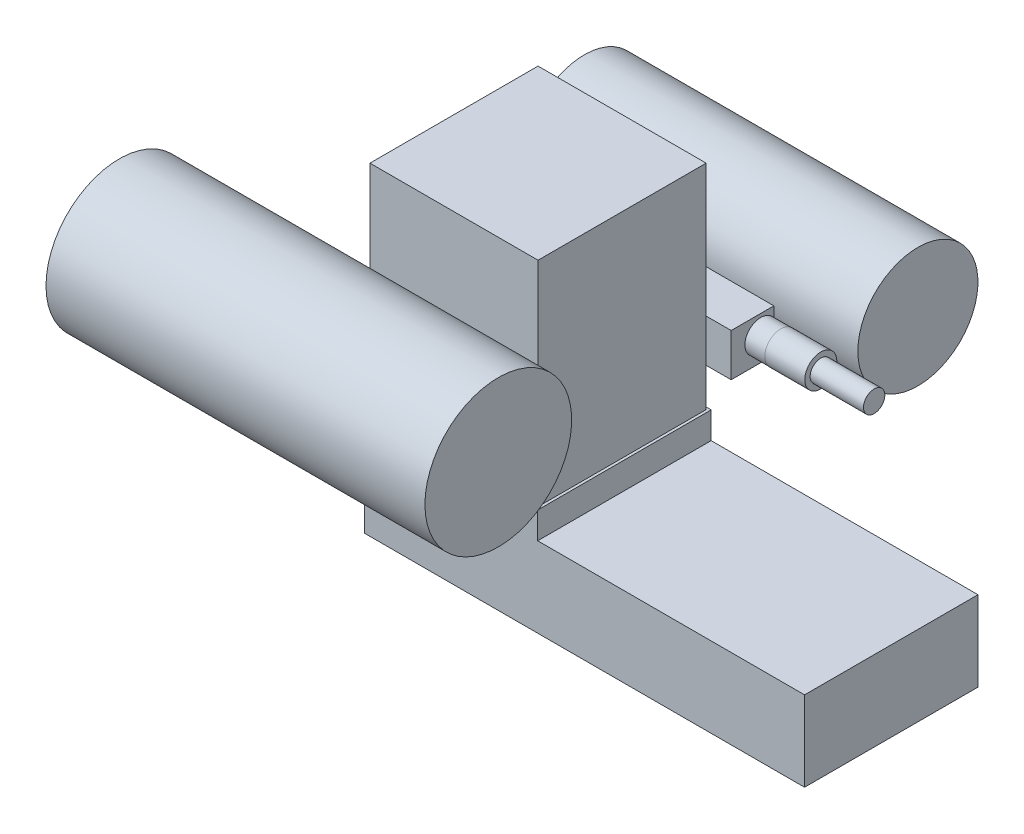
SolidWorks part; units mm, degrees
other "Spindle"
other "Compound"
other "Toolpost Holder"
other "Spindle Barrel"
other "Motor"
other "Toolpost"
ref_plane "Front Plane" through (0, 0, 0) normal (0, 0, 1) x (1, 0, 0)
ref_plane "Top Plane" through (0, 0, 0) normal (0, 1, 0) x (1, 0, 0)
ref_plane "Right Plane" through (0, 0, 0) normal (1, 0, 0) x (0, 0, -1)
sketch "Sketch1" plane through (0, 0, 0) normal (0, 1, 0) x (1, 0, 0)
  line L1 (-32.5, 32.5) -> (32.5, 32.5)
  line L2 (-32.5, 32.5) -> (-32.5, -32.5)
  line L3 (-32.5, -32.5) -> (32.5, -32.5)
  line L4 (32.5, 32.5) -> (32.5, -32.5)
  line L5 (-32.5, 32.5) -> (32.5, -32.5) construction
  line L6 (-32.5, -32.5) -> (32.5, 32.5) construction
  point P0 (0, 0)
  dimension "D1" = 65
  dimension "D2" = 65
extrude "Boss-Extrude1" add sketch "Sketch1" against normal blind 40
sketch "Sketch2" plane through (32.5, 0, 0) normal (1, 0, 0) x (0, 0, -1)
  line L0 (32.5, -40) -> (32.5, 0) construction
  line L1 (-32.5, -40) -> (32.5, -40)
  line L2 (-32.5, -40) -> (-32.5, -10)
  line L3 (-32.5, -10) -> (32.5, -10)
  line L4 (32.5, -40) -> (32.5, -10)
  line L5 (-32.5, 0) -> (32.5, 0) construction
  dimension "D1" = 10
extrude "Boss-Extrude2" add sketch "Sketch2" along normal blind 100
sketch "Sketch3" plane through (0, 0, 0) normal (0, 1, 0) x (1, 0, 0)
  line L0 (32.5, 32.5) -> (-32.5, 32.5) construction
  line L1 (-11.2, 32.5) -> (11.2, 32.5)
  line L2 (-11.2, 32.5) -> (-11.2, -32.5)
  line L3 (-11.2, -32.5) -> (11.2, -32.5)
  line L4 (11.2, 32.5) -> (11.2, -32.5)
  line L5 (-32.5, -32.5) -> (32.5, -32.5) construction
  line L6 (-32.5, 32.5) -> (-32.5, -32.5) construction
  line L7 (32.5, -32.5) -> (32.5, 32.5) construction
  dimension "D1" = 22.4
  dimension "D2" = 21.3
  dimension "D3" = 21.3
extrude "Cut-Extrude1" cut sketch "Sketch3" against normal blind 5
sketch "Sketch4" plane through (0, 0, 32.5) normal (0, 0, 1) x (1, 0, 0)
  line L0 (-11.2, -5) -> (11.2, -5) construction
  line L1 (-19.2, -5) -> (19.2, -5)
  line L2 (-19.2, -5) -> (-19.2, -11)
  line L3 (-19.2, -11) -> (19.2, -11)
  line L4 (19.2, -5) -> (19.2, -11)
  line L6 (-11.2, -5) -> (-11.2, -11) construction
  line L7 (11.2, -5) -> (11.2, -11) construction
  line L8 (-11.2, -8) -> (-19.2, -8) construction
  line L9 (11.2, -8) -> (19.2, -8) construction
  dimension "D1" = 8
  dimension "D2" = 6
extrude "Cut-Extrude2" cut sketch "Sketch4" against normal up to next
ref_plane "Centreline" through (0, 21.5, 0) normal (0, 1, 0) x (1, 0, 0)
sketch "Sketch6" plane through (0, 21.5, 0) normal (0, 1, 0) x (1, 0, 0)
  line L0 (-11.2, 32.5) -> (-11.2, -32.5) construction
  line L1 (-40, 48.5) -> (40, 48.5)
  line L2 (-40, 48.5) -> (-40, 32.5)
  line L3 (-40, 32.5) -> (40, 32.5)
  line L4 (40, 48.5) -> (40, 32.5)
  line L5 (11.2, -32.5) -> (11.2, 32.5) construction
  line L6 (-11.2, 32.5) -> (-11.2, -32.5) construction
  line L7 (11.2, -32.5) -> (11.2, 32.5) construction
  line L8 (40, 40.5) -> (11.2, 40.5) construction
  line L9 (-40, 40.5) -> (-11.2, 40.5) construction
  line L10 (32.5, 32.5) -> (11.2, 32.5) construction
  line L11 (32.5, 32.5) -> (11.2, 32.5) construction
  dimension "D1" = 16
  dimension "D2" = 80
extrude "Boss-Extrude3" add sketch "Sketch6" along normal mid plane 16 separate body
ref_plane "Plane2" through (0, 0, 0) normal (-1, 0, 0) x (0, 0, 1)
sketch "Sketch8" plane through (0, 0, 0) normal (-1, 0, 0) x (0, 0, 1)
  line L0 (-48.5, 29.5) -> (-48.5, 13.5) construction
  line L1 (-48.5, 29.5) -> (-48.5, 13.5) construction
  line L3 (-48.5, 21.5) -> (-128.3273, 21.5) construction
  circle A0 centre (-79.9718, 21.5) radius 17.5 construction
  circle A1 centre (-79.9718, 21.5) radius 22.5
  dimension "D1" = 35
  dimension "D2" = 45
extrude "Boss-Extrude4" add sketch "Sketch8" along normal mid plane 125 separate body
ref_plane "Motor Plane" through (-80, 0, 0) normal (-1, 0, 0) x (0, 0, 1)
sketch "Sketch9" plane through (-80, 0, 0) normal (-1, 0, 0) x (0, 0, 1)
  circle A0 centre (76.7677, 52.3678) radius 27.5
  dimension "D1" = 55
extrude "Boss-Extrude5" add sketch "Sketch9" against normal blind 142 separate body
sketch "Sketch10" plane through (0, 0, 0) normal (0, 1, 0) x (1, 0, 0)
  line L0 (11.2, -32.5) -> (11.2, 32.5) construction
  line L1 (-31.5, -31.3763) -> (31.5, -31.3763)
  line L2 (-31.5, -31.3763) -> (-31.5, 31.6237)
  line L3 (-31.5, 31.6237) -> (31.5, 31.6237)
  line L4 (31.5, -31.3763) -> (31.5, 31.6237)
  line L5 (-11.2, 32.5) -> (-11.2, -32.5) construction
  line L6 (11.2, -32.5) -> (11.2, 32.5) construction
  line L7 (-11.2, 32.5) -> (-11.2, -32.5) construction
  line L8 (-11.2, -9.2276) -> (-31.5, -9.2276) construction
  line L9 (11.2, -9.2276) -> (31.5, -9.2276) construction
  dimension "D1" = 63
extrude "Boss-Extrude6" add sketch "Sketch10" along normal blind 80 separate body
ref_plane "Spindle Plane" through (-60, 0, 0) normal (-1, 0, 0) x (0, 0, 1)
sketch "Sketch12" plane through (-60, 0, 0) normal (-1, 0, 0) x (0, 0, 1)
  circle A0 centre (-43.5879, 22.237) radius 7.5
  dimension "D1" = 15
extrude "Boss-Extrude7" add sketch "Sketch12" along normal blind 15 draft 7 separate body
sketch "Sketch17" plane through (-60, 0, 0) normal (1, 0, 0) x (0, 0, -1)
  circle A0 centre (43.5879, 22.237) radius 7.5 construction
  circle A1 centre (43.5879, 22.237) radius 7.5
extrude "Boss-Extrude8" add sketch "Sketch17" along normal blind 15
sketch "Sketch18" plane through (-45, 0, 0) normal (1, 0, 0) x (0, 0, -1)
  circle A0 centre (43.5879, 22.237) radius 9.5
  dimension "D1" = 19
extrude "Boss-Extrude9" add sketch "Sketch18" along normal blind 3
sketch "Sketch19" plane through (-42, 0, 0) normal (1, 0, 0) x (0, 0, -1)
  circle A0 centre (43.5879, 22.237) radius 7.5
  dimension "D1" = 15
extrude "Boss-Extrude10" add sketch "Sketch19" along normal blind 21.5
sketch "Sketch20" plane through (-20.5, 0, 0) normal (1, 0, 0) x (0, 0, -1)
  circle A0 centre (43.5879, 22.237) radius 6.95
  dimension "D1" = 13.9
extrude "Boss-Extrude11" add sketch "Sketch20" along normal blind 8
sketch "Sketch22" plane through (-12.5, 0, 0) normal (1, 0, 0) x (0, 0, -1)
  circle A0 centre (43.5879, 22.237) radius 5.95
  dimension "D1" = 11.9
extrude "Boss-Extrude12" add sketch "Sketch22" along normal blind 60
sketch "Sketch23" plane through (47.5, 0, 0) normal (1, 0, 0) x (0, 0, -1)
  circle A0 centre (43.5879, 22.237) radius 6
  dimension "D1" = 12
extrude "Boss-Extrude13" add sketch "Sketch23" along normal blind 15
sketch "Sketch24" plane through (62.5, 0, 0) normal (1, 0, 0) x (0, 0, -1)
  circle A0 centre (43.5879, 22.237) radius 4
  dimension "D1" = 8
extrude "Boss-Extrude14" add sketch "Sketch24" along normal blind 20
thread "Thread1" pitch 1.5 start angle 0, offset 5, length 0, pitch 1.5, diameter 13.9
ref_plane "Plane4" through (-7.5, 22.237, -36.6379) normal (0, -1, 0) x (0, 0, 1)
sketch "Thread Profile1" plane through (-7.5, 22.237, -36.6379) normal (0, -1, 0) x (0, 0, 1)
  line L0 (0, 0) -> (0, 1.5) construction
  line L11 (0, 0) -> (0, 1.3125)
  line L12 (0, 1.3125) -> (-0.8119, 0.8437)
  line L13 (-0.8119, 0.8437) -> (-0.8119, 0.4687)
  line L15 (-0.8119, 0.4687) -> (0, 0)
  line L17 (-0.8119, 0.6562) -> (0, 0.6562) construction
  point P2 (0, 0)
  dimension "Pitch" = 1.5
  dimension "Profile_Angle" = 60
  dimension "Profile_Land" = 0.375
  dimension "Profile_Height" = 0.8119
